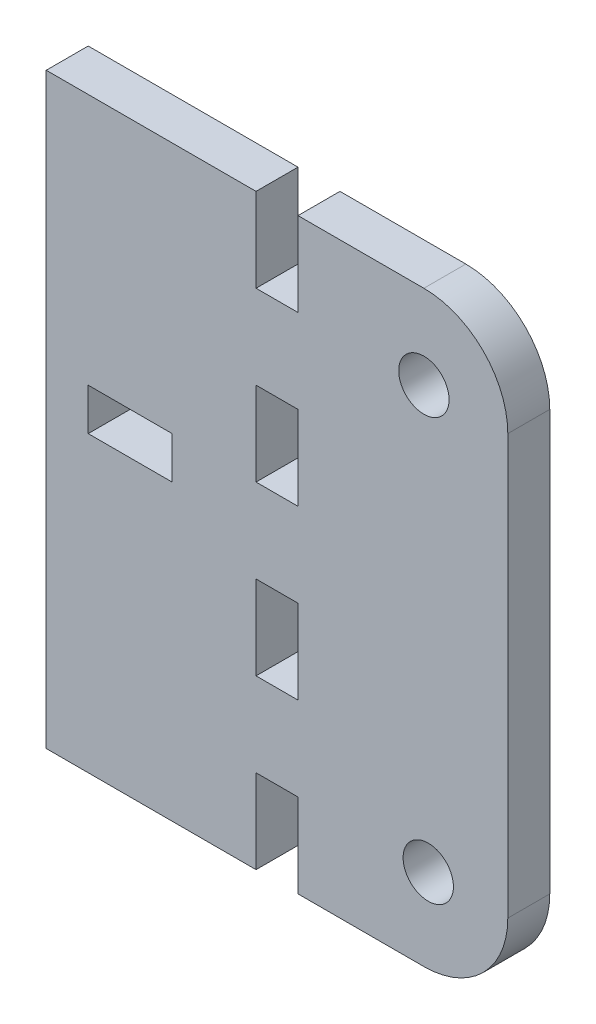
SolidWorks part; units mm, degrees
ref_plane "Plan de face" through (0, 0, 0) normal (0, 0, 1) x (1, 0, 0)
ref_plane "Plan de dessus" through (0, 0, 0) normal (0, 1, 0) x (1, 0, 0)
ref_plane "Plan de droite" through (0, 0, 0) normal (1, 0, 0) x (0, 0, -1)
sketch "Esquisse1" plane through (0, 0, 0) normal (0, 0, 1) x (1, 0, 0)
  line L1 (0, -35) -> (-30, -35)
  line L2 (0, -35) -> (0, 35)
  line L3 (0, 35) -> (-30, 35)
  line L4 (-30, -35) -> (-30, 35)
  dimension "D1" = 30
  dimension "D2" = 70
  dimension "D3" = 35
extrude "Boss.-Extru.1" add sketch "Esquisse1" along normal blind 5
sketch "Esquisse2" plane through (0, 0, 5) normal (0, 0, 1) x (1, 0, 0)
  line L1 (-15, 0) -> (-25, 0)
  line L2 (-15, 0) -> (-15, 5)
  line L3 (-15, 5) -> (-25, 5)
  line L4 (-25, 0) -> (-25, 5)
  dimension "D2" = 10
  dimension "D1" = 15
  dimension "D3" = 5
extrude "Enlèv. mat.-Extru.1" cut sketch "Esquisse2" against normal blind 5
sketch "Esquisse3" plane through (0, 0, 5) normal (0, 0, 1) x (1, 0, 0)
  line L0 (0, -35) -> (0, 35) construction
  line L1 (0, -35) -> (-5, -35)
  line L2 (0, -35) -> (0, -25)
  line L3 (0, -25) -> (-5, -25)
  line L4 (-5, -35) -> (-5, -25)
  line L5 (0, -5) -> (-5, -5)
  line L6 (0, -15) -> (0, -5)
  line L7 (0, -15) -> (-5, -15)
  line L8 (-5, -15) -> (-5, -5)
  line L9 (0, 15) -> (-5, 15)
  line L10 (0, 5) -> (0, 15)
  line L11 (0, 5) -> (-5, 5)
  line L12 (-5, 5) -> (-5, 15)
  line L13 (0, 35) -> (-5, 35)
  line L14 (0, 25) -> (0, 35)
  line L15 (0, 25) -> (-5, 25)
  line L16 (-5, 25) -> (-5, 35)
  dimension "D1" = 5
  dimension "D2" = 10
  dimension "D3" = 25
  dimension "D4" = 4
extrude "Enlèv. mat.-Extru.2" cut sketch "Esquisse3" against normal blind 10
sketch "Esquisse4" plane through (0, 0, 0) normal (1, 0, 0) x (0, 0, -1)
  line L1 (-5, 35) -> (0, 35)
  line L2 (-5, 35) -> (-5, -35)
  line L3 (-5, -35) -> (0, -35)
  line L4 (0, 35) -> (0, -35)
extrude "Boss.-Extru.2" add sketch "Esquisse4" along normal blind 25
sketch "Esquisse5" plane through (0, 0, 5) normal (0, 0, 1) x (1, 0, 0)
  line L0 (0, 35) -> (0, 25) construction
  line L1 (25, 35) -> (0, 35) construction
  line L2 (15, 25) -> (15.5207, -25) construction
  line L3 (25, -35) -> (0, -35) construction
  circle A0 centre (15, 25) radius 3
  circle A1 centre (15.5207, -25) radius 3
  dimension "D4" = 6
  dimension "D5" = 6
  dimension "D1" = 15
  dimension "D2" = 10
  dimension "D3" = 10
extrude "Enlèv. mat.-Extru.3" cut sketch "Esquisse5" against normal blind 5
fillet "Congé1" radius 10 2 edges at (25, 35, 2.5) (25, -35, 2.5)
